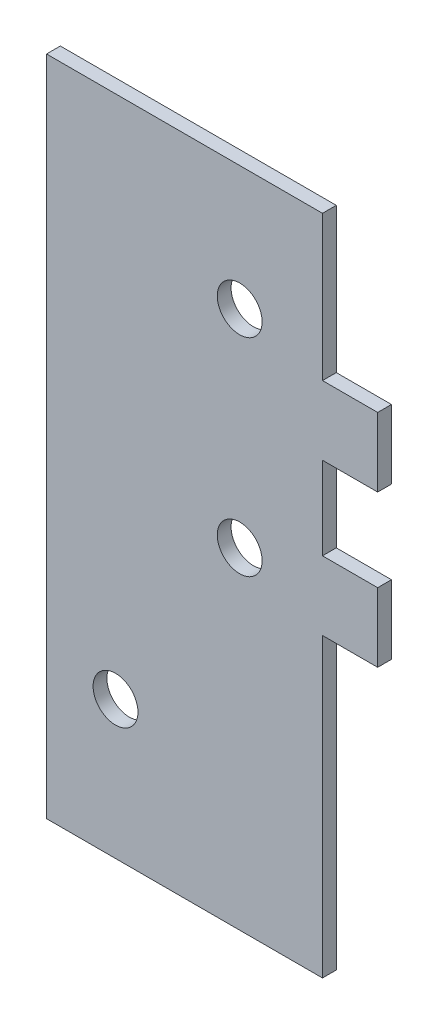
SolidWorks part; units mm, degrees
ref_plane "Front Plane" through (0, 0, 0) normal (0, 0, 1) x (1, 0, 0)
ref_plane "Top Plane" through (0, 0, 0) normal (0, 1, 0) x (1, 0, 0)
ref_plane "Right Plane" through (0, 0, 0) normal (1, 0, 0) x (0, 0, -1)
sketch "Sketch1" plane through (0, 0, 0) normal (0, 0, 1) x (1, 0, 0)
  line L0 (0, 0) -> (127, 0)
  line L1 (127, 0) -> (127, 136.525)
  line L2 (127, 136.525) -> (152.4, 136.525)
  line L3 (152.4, 136.525) -> (152.4, 168.275)
  line L4 (152.4, 168.275) -> (127, 168.275)
  line L5 (127, 168.275) -> (127, 206.375)
  line L6 (127, 206.375) -> (152.4, 206.375)
  line L7 (152.4, 206.375) -> (152.4, 238.125)
  line L8 (152.4, 238.125) -> (127, 238.125)
  line L9 (127, 238.125) -> (127, 304.8)
  line L10 (127, 304.8) -> (0, 304.8)
  line L11 (0, 304.8) -> (0, 0)
  circle A0 centre (88.9, 247.65) radius 10.3187
  circle A1 centre (88.9, 152.4) radius 10.3187
  circle A2 centre (31.75, 63.5) radius 10.3188
  dimension "D9" = 95.25
  dimension "D11" = 20.6375
  dimension "D1" = 127
  dimension "D2" = 25.4
  dimension "D3" = 304.8
  dimension "D4" = 38.1
  dimension "D5" = 31.75
  dimension "D6" = 31.75
  dimension "D7" = 66.675
  dimension "D8" = 152.4
  dimension "D10" = 38.1
  dimension "D12" = 63.5
  dimension "D13" = 95.25
extrude "Boss-Extrude1" add sketch "Sketch1" along normal blind 6.35
